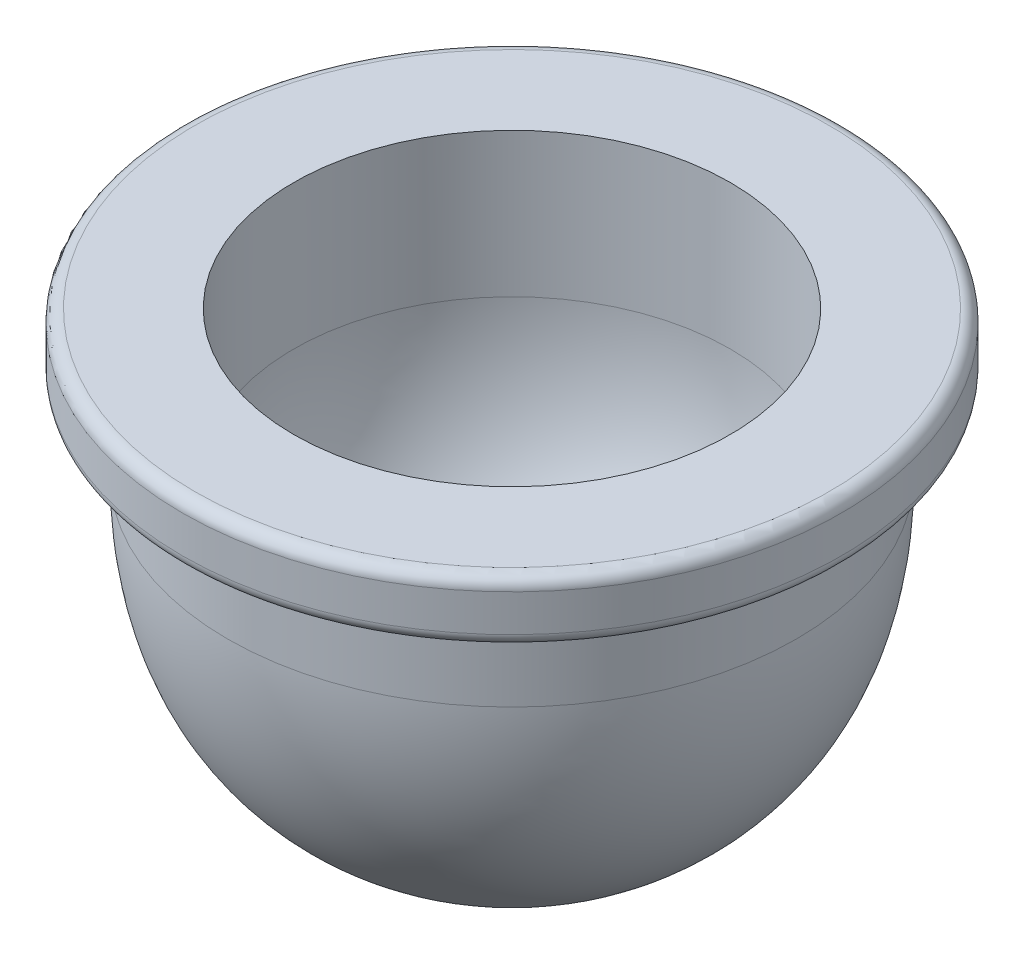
SolidWorks part; units mm, degrees
ref_plane "Front Plane" through (0, 0, 0) normal (0, 0, 1) x (1, 0, 0)
ref_plane "Top Plane" through (0, 0, 0) normal (0, 1, 0) x (1, 0, 0)
ref_plane "Right Plane" through (0, 0, 0) normal (1, 0, 0) x (0, 0, -1)
sketch "Sketch1" plane through (0, 0, 0) normal (0, 0, 1) x (1, 0, 0)
  line L0 (-3, -11) -> (0, -11) construction
  line L1 (0, -11) -> (0, 0) construction
  line L2 (0, 0) -> (6.9, 0) construction
  line L3 (6.9, -1.5) -> (6.9, -3.5)
  line L4 (5.3, 0) -> (5.3, -3.5)
  line L5 (5.3, 0) -> (8, 0)
  line L6 (8, 0) -> (8, -1.5)
  line L7 (8, -1.5) -> (6.9, -1.5)
  line L8 (6.9, 0) -> (6.9, -3.5) construction
  line L9 (0, -9.4) -> (0, -11)
  spline S0 degree 3 poles (6.9, -3.5) (6.9, -8.6427) (3.3971, -11) (0, -11) knots 0 0 0 0 1 1 1 1
  spline S1 degree 1 poles (5.3, -3.5) (0, -9.4) knots 0 0 1 1 construction
  spline S2 degree 3 poles (5.3, -3.5) (5.3, -3.7639) (5.2765, -4.3085) (5.1458, -5.2569) (4.8444, -6.2836) (4.3128, -7.2665) (3.4204, -8.3064) (2.0032, -9.1661) (0.6606, -9.4) (0, -9.4) knots 0 0 0 0 0.0625 0.125 0.25 0.375 0.5 0.75 1 1 1 1
  dimension "D1" = 3
  dimension "D2" = 11
  dimension "D3" = 6.9
  dimension "D4" = 3.5
  dimension "D6" = 8
  dimension "D7" = 1.5
  dimension "D5" = 3.5
  dimension "D8" = 1.6
revolve "Revolve2" add sketch "Sketch1" angle 360 about L1
fillet "Fillet2" radius 0.3 2 edges at (0, -1.5, -8) (0, 0, -8)
